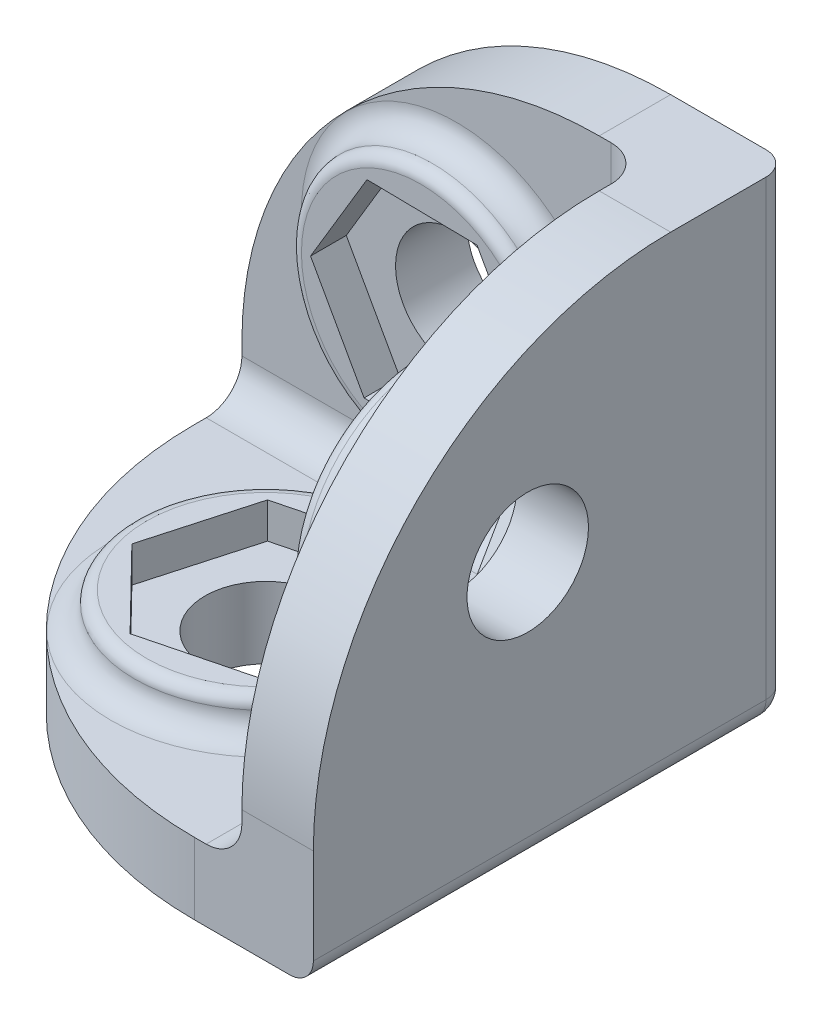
SolidWorks part; units mm, degrees
ref_plane "Plan de face" through (0, 0, 0) normal (0, 0, 1) x (1, 0, 0)
ref_plane "Plan de dessus" through (0, 0, 0) normal (0, 1, 0) x (1, 0, 0)
ref_plane "Plan de droite" through (0, 0, 0) normal (1, 0, 0) x (0, 0, -1)
sketch "Esquisse1" plane through (0, 0, 0) normal (0, 1, 0) x (1, 0, 0)
  line L0 (-12.7672, 7.8372) -> (7.2328, 7.8372)
  line L1 (7.2328, 7.8372) -> (7.2328, -12.1628)
  line L2 (7.2328, -12.1628) -> (2.2328, -12.1628)
  line L4 (-12.7672, 2.8372) -> (-12.7672, 7.8372)
  circle A0 centre (-3.7672, -3.1628) radius 2.55
  arc A1 (-12.7672, 2.8372) -> (2.2328, -12.1628) centre (2.2328, 2.8372) ccw
  dimension "D2" = 5.1
  dimension "D1" = 20
  dimension "D3" = 11
  dimension "D4" = 11
  dimension "D5" = 20
  dimension "D6" = 5
  dimension "D7" = 5
extrude "Boss.-Extru.1" add sketch "Esquisse1" along normal blind 3
sketch "Esquisse2" plane through (0, 0, -7.8372) normal (0, 0, -1) x (-1, 0, 0)
  line L0 (-7.2328, 3) -> (-7.2328, 20)
  line L1 (-7.2328, 20) -> (-2.2328, 20)
  line L3 (12.7672, 3) -> (12.7672, 5)
  line L4 (-7.2328, 0) -> (12.7672, 0) construction
  circle A0 centre (3.7672, 11) radius 2.55
  arc A1 (-2.2328, 20) -> (12.7672, 5) centre (-2.2328, 5) cw
  dimension "D6" = 5.1
  dimension "D1" = 20
  dimension "D2" = 5
  dimension "D3" = 11
  dimension "D4" = 11
  dimension "D5" = 5
extrude "Boss.-Extru.2" add sketch "Esquisse2" against normal blind 3 contours A1 L1 L0 L3 A0 M3
sketch "Esquisse3" plane through (7.2328, 0, 0) normal (1, 0, 0) x (0, 0, -1)
  line L0 (-12.1628, 3) -> (-12.1628, 5)
  line L1 (4.8372, 20) -> (2.8372, 20)
  line L2 (-12.1628, 0) -> (7.8372, 0) construction
  line L3 (7.8372, 20) -> (7.8372, 0) construction
  circle A0 centre (-3.1628, 11) radius 2.55
  arc A1 (-12.1628, 5) -> (2.8372, 20) centre (2.8372, 5) cw
  dimension "D5" = 5.1
  dimension "D1" = 5
  dimension "D2" = 5
  dimension "D3" = 11
  dimension "D4" = 11
extrude "Boss.-Extru.3" add sketch "Esquisse3" against normal blind 3 contours A1 L0 L1 A0 M5 M4
fillet "Congé1" radius 1.5 3 edges at (4.2328, 11.5, -4.8372) (4.2328, 3, 3.6628)
sketch "Esquisse4" plane through (0, 3, 0) normal (0, 1, 0) x (1, 0, 0)
  line L1 (-6.9954, 0.1406) -> (-8.2421, -4.3068)
  line L2 (-8.2421, -4.3068) -> (-5.0139, -7.6102)
  line L3 (-5.0139, -7.6102) -> (-0.539, -6.4661)
  line L4 (-0.539, -6.4661) -> (0.7077, -2.0188)
  line L5 (0.7077, -2.0188) -> (-2.5205, 1.2846)
  line L6 (-2.5205, 1.2846) -> (-6.9954, 0.1406)
  circle A0 centre (-3.7672, -3.1628) radius 4 construction
  circle A5 centre (-3.7672, -3.1628) radius 5.5
  dimension "D2" = 11
  dimension "D1" = 8
extrude "Boss.-Extru.4" add sketch "Esquisse4" along normal blind 1.5
fillet "Congé2" radius 1 1 edges at (-3.7672, 3, 8.6628)
fillet "Congé3" radius 1 3 edges at (7.2328, 0, 2.1628) (7.2328, 10, -7.8372) (-2.7672, 0, -7.8372)
fillet "Congé4" radius 0.5 1 edges at (-3.7672, 4.5, 8.6628)
sketch "Esquisse8" plane through (0, 0, -4.8372) normal (0, 0, 1) x (1, 0, 0)
  line L1 (-1.5194, 6.965) -> (0.8511, 10.9292)
  line L2 (0.8511, 10.9292) -> (-1.3967, 14.9641)
  line L3 (-1.3967, 14.9641) -> (-6.015, 15.035)
  line L4 (-6.015, 15.035) -> (-8.3855, 11.0708)
  line L5 (-8.3855, 11.0708) -> (-6.1377, 7.0359)
  line L6 (-6.1377, 7.0359) -> (-1.5194, 6.965)
  circle A0 centre (-3.7672, 11) radius 4 construction
  circle A1 centre (-3.7672, 11) radius 5.5
  dimension "D1" = 8
sketch "Esquisse9" plane through (4.2328, 0, 0) normal (-1, 0, 0) x (0, 0, 1)
  line L1 (0.8534, 7) -> (5.4722, 7)
  line L2 (5.4722, 7) -> (7.7816, 11)
  line L3 (7.7816, 11) -> (5.4722, 15)
  line L4 (5.4722, 15) -> (0.8534, 15)
  line L5 (0.8534, 15) -> (-1.456, 11)
  line L6 (-1.456, 11) -> (0.8534, 7)
  circle A0 centre (3.1628, 11) radius 4 construction
  circle A1 centre (3.1628, 11) radius 5.5
  dimension "D1" = 8
extrude "Boss.-Extru.5" add sketch "Esquisse8" along normal blind 1.5
extrude "Boss.-Extru.6" add sketch "Esquisse9" along normal blind 1.5
fillet "Congé5" radius 0.5 1 edges at (2.7328, 11, 8.6628)
fillet "Congé6" radius 1 1 edges at (4.2328, 11, -2.3372)
fillet "Congé7" radius 0.5 1 edges at (1.7328, 11, -3.3372)
fillet "Congé8" radius 1 1 edges at (-9.2672, 11, -4.8372)
